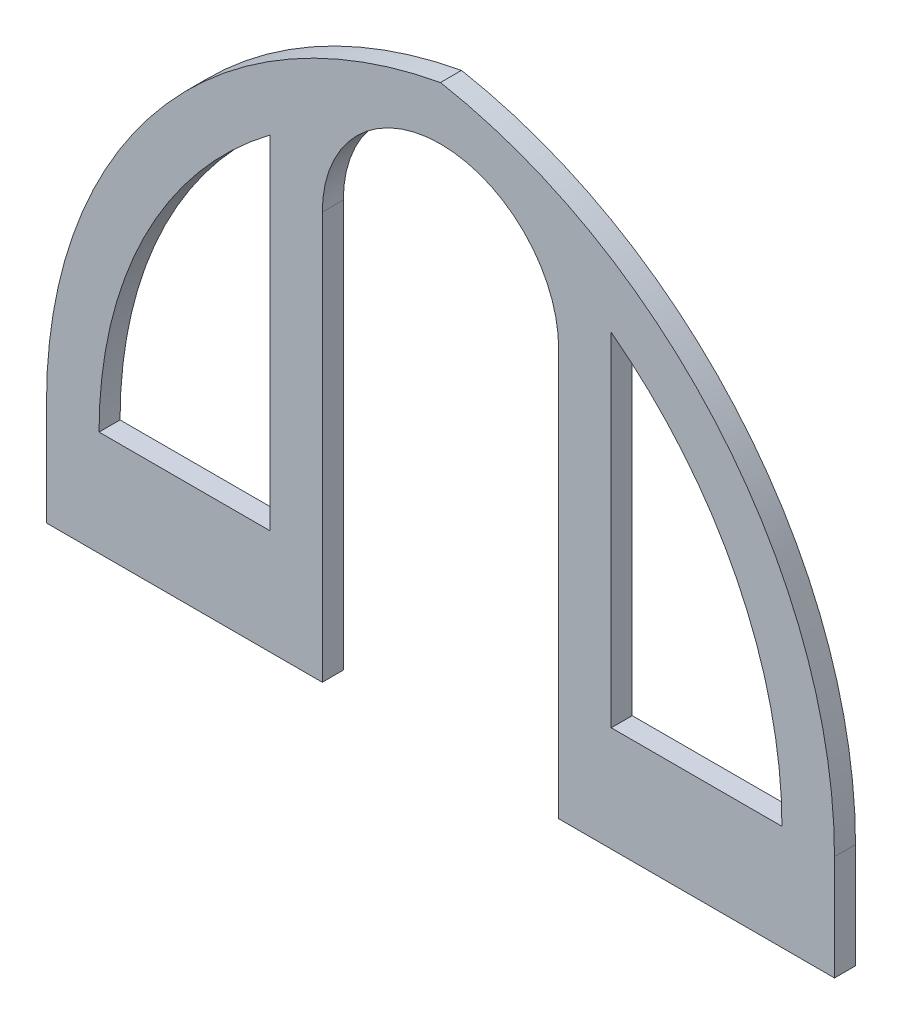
SolidWorks part; units mm, degrees
ref_plane "Alzado" through (0, 0, 0) normal (0, 0, 1) x (1, 0, 0)
ref_plane "Planta" through (0, 0, 0) normal (0, 1, 0) x (1, 0, 0)
ref_plane "Vista lateral" through (0, 0, 0) normal (1, 0, 0) x (0, 0, -1)
sketch "Croquis1" plane through (0, 0, 0) normal (0, 0, 1) x (1, 0, 0)
  line L0 (-1492.5516, -491.3706) -> (-1492.5516, -91.3706)
  line L1 (1507.4484, -491.3706) -> (457.4484, -491.3706)
  line L2 (-442.5516, -491.3706) -> (-1492.5516, -491.3706)
  line L3 (1507.4484, -491.3706) -> (1507.4484, -91.3706)
  line L4 (-442.5516, 1058.6294) -> (-442.5516, -491.3706)
  line L6 (457.4484, 1058.6294) -> (457.4484, -491.3706)
  line L7 (-1292.5516, -91.3706) -> (-642.5516, -91.3706)
  line L8 (657.4484, 1212.6415) -> (657.4484, -91.3706)
  line L9 (-642.5516, 1212.6415) -> (-642.5516, -91.3706)
  line L10 (1307.4484, -91.3706) -> (657.4484, -91.3706)
  line L11 (657.4484, 1058.6294) -> (657.4484, -291.3706) construction
  line L12 (-642.5516, -291.3706) -> (-1292.5516, -291.3706) construction
  line L13 (1307.4484, -291.3706) -> (657.4484, -291.3706) construction
  line L14 (-642.5516, 1058.6294) -> (-642.5516, -291.3706) construction
  line L15 (-1292.5516, -291.3706) -> (-1292.5516, -91.3706) construction
  line L16 (1307.4484, -291.3706) -> (1307.4484, -91.3706) construction
  arc A0 (-1492.5516, -91.3706) -> (7.4484, 1711.158) centre (340.4849, -91.3706) cw
  arc A1 (1507.4484, -91.3706) -> (7.4484, 1711.158) centre (-325.5881, -91.3706) ccw
  arc A2 (-1292.5516, -91.3706) -> (-642.5516, 1212.6415) centre (340.4849, -91.3706) cw
  arc A3 (457.4484, 1058.6294) -> (-442.5516, 1058.6294) centre (7.4484, 1058.6294) ccw
  arc A4 (1307.4484, -91.3706) -> (657.4484, 1212.6415) centre (-325.5881, -91.3706) ccw
  arc A8 (657.4484, 1058.6294) -> (-642.5516, 1058.6294) centre (7.4484, 1058.6294) ccw construction
  arc A10 (-1292.5516, -91.3706) -> (7.4484, 1507.346) centre (340.4849, -91.3706) cw construction
  arc A12 (1307.4484, -91.3706) -> (7.4484, 1507.346) centre (-325.5881, -91.3706) ccw construction
  dimension "D2" = 200
  dimension "D1" = 3000
  dimension "D4" = 400
extrude "Saliente-Extruir1" add sketch "Croquis1" along normal blind 80
